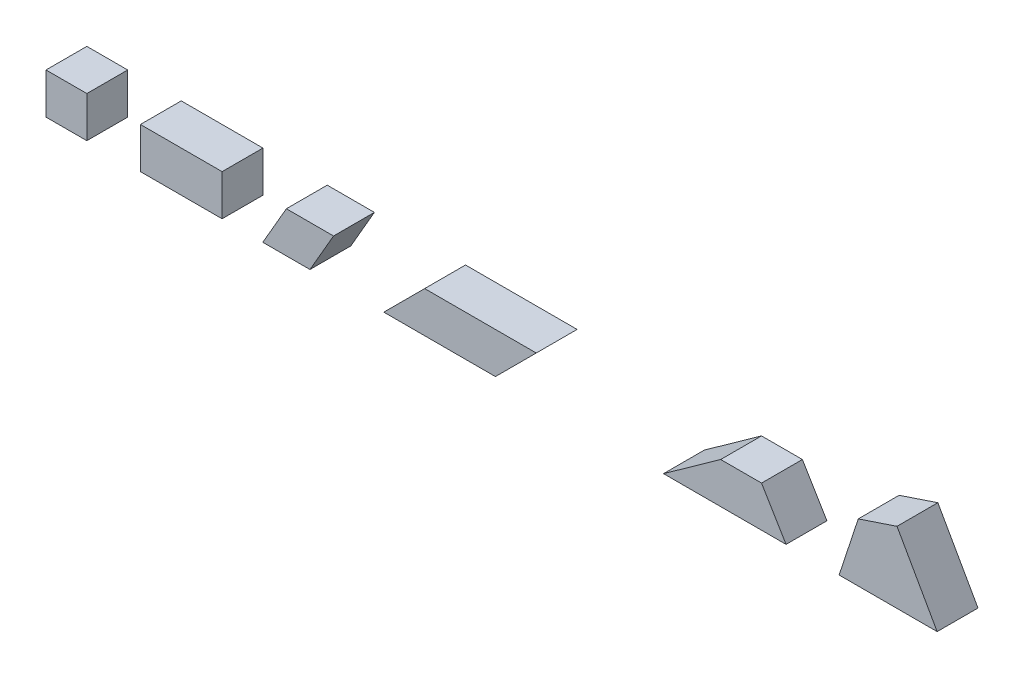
SolidWorks part; units mm, degrees
other "DetailItem1"
other "DetailItem1"
other "DetailItem1"
other "DetailItem1"
other "DetailItem1"
other "DetailItem1"
other "DetailItem2"
other "DetailItem3"
other "DetailItem4"
other "DetailItem5"
other "DetailItem6"
other "DetailItem7"
ref_plane "Front" through (0, 0, 0) normal (0, 0, 1) x (1, 0, 0)
ref_plane "Top" through (0, 0, 0) normal (0, 1, 0) x (1, 0, 0)
ref_plane "Right" through (0, 0, 0) normal (1, 0, 0) x (0, 0, -1)
sketch "Sketch1" plane through (0, 0, 0) normal (0, 0, 1) x (1, 0, 0)
  line L0 (265.3517, 0) -> (323.0867, 0)
  line L1 (0, 0) -> (50, 0)
  line L2 (0, 0) -> (0, 50)
  line L3 (0, 50) -> (50, 50)
  line L4 (50, 0) -> (50, 50)
  line L5 (115.5473, 50) -> (215.5473, 50)
  line L6 (115.5473, 50) -> (115.5473, 0)
  line L7 (115.5473, 0) -> (215.5473, 0)
  line L8 (215.5473, 50) -> (215.5473, 0)
  line L9 (323.0867, 0) -> (351.9542, 50)
  line L10 (351.9542, 50) -> (294.2192, 50)
  line L11 (294.2192, 50) -> (265.3517, 0)
  line L12 (413.473, 0) -> (550.0755, 0)
  line L13 (550.0755, 0) -> (600.0755, 50)
  line L14 (600.0755, 50) -> (463.473, 50)
  line L15 (463.473, 50) -> (413.473, 0)
  line L18 (755.8286, 0) -> (905.8286, 0)
  line L19 (905.8286, 0) -> (875.8286, 50)
  line L20 (875.8286, 50) -> (825.8286, 50)
  line L21 (825.8286, 50) -> (755.8286, 0)
  line L22 (970.7601, 0) -> (1090.7601, 0)
  line L23 (1090.7601, 0) -> (1041.6192, 87.0929)
  line L24 (1041.6192, 87.0929) -> (994.1976, 71.2438)
  line L25 (994.1976, 71.2438) -> (970.7601, 0)
  line L26 (994.1976, 71.2438) -> (1090.7601, 0) construction
  dimension "D1" = 50
  dimension "D2" = 100
  dimension "D3" = 50
  dimension "D4" = 50
  dimension "D5" = 100
  dimension "D6" = 50
  dimension "D7" = 193.1852
  dimension "D8" = 100
  dimension "D9" = 50
  dimension "D10" = 50
  dimension "D11" = 150
  dimension "D12" = 120
  dimension "D13" = 120
  dimension "D14" = 100
  dimension "D15" = 50
  dimension "D16" = 75
  dimension "D17" = 120
extrude "Extrude1" add sketch "Sketch1" along normal blind 50
